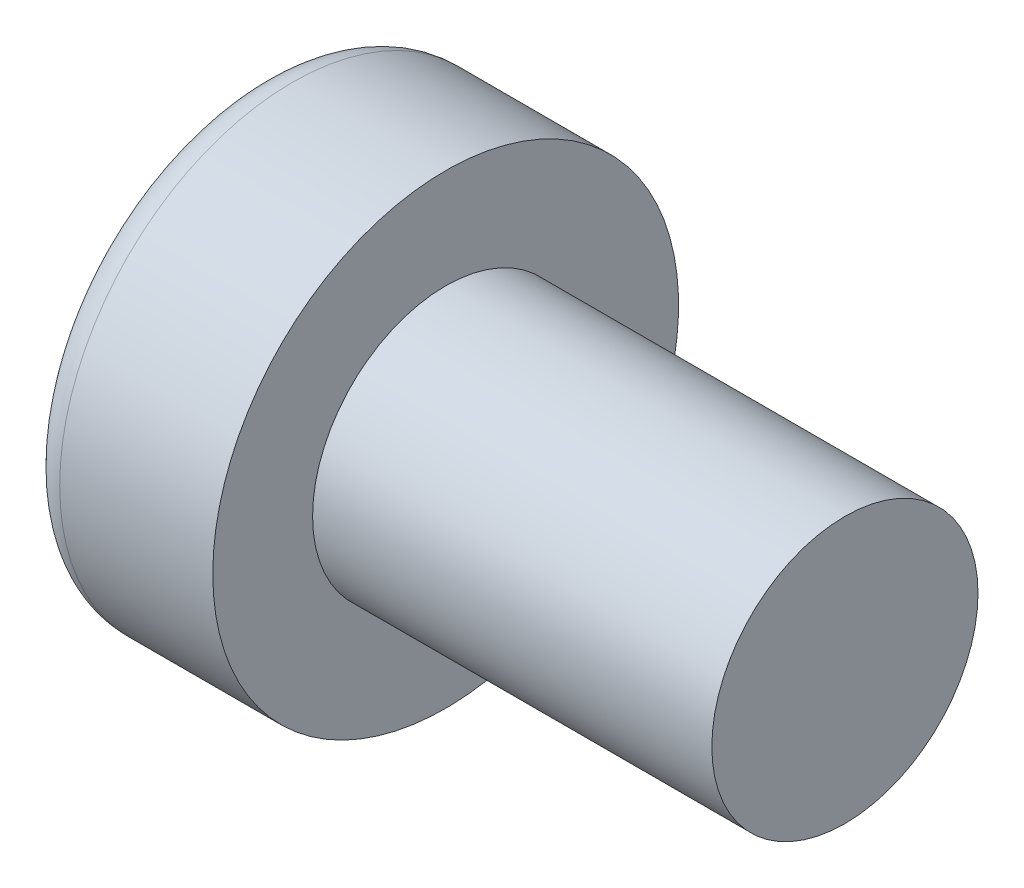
SolidWorks part; units mm, degrees
ref_plane "Ebene vorne" through (0, 0, 0) normal (0, 0, 1) x (1, 0, 0)
ref_plane "Ebene oben" through (0, 0, 0) normal (0, 1, 0) x (1, 0, 0)
ref_plane "Ebene rechts" through (0, 0, 0) normal (1, 0, 0) x (0, 0, -1)
sketch "Skizze1" plane through (0, 0, 0) normal (0, 0, 1) x (1, 0, 0)
  line L0 (-65.0118, 0) -> (64.6036, 0) construction
  line L1 (-8.8, 0) -> (-8.8, 3.5)
  line L2 (-8.8, 3.5) -> (-6, 3.5)
  line L3 (-6, 3.5) -> (-6, 2)
  line L4 (-6, 2) -> (0, 2)
  line L5 (0, 2) -> (0, 0)
  line L6 (0, 0) -> (-8.8, 0)
  dimension "D1" = 4
  dimension "D2" = 6
  dimension "D3" = 7
  dimension "D4" = 2.8
revolve "Rotation1" add sketch "Skizze1" angle 360 about L0
fillet "Verrundung1" radius 0.5 1 edges at (-8.8, 0, 3.5)
sketch "Skizze2" plane through (-8.8, 0, 0) normal (-1, 0, 0) x (0, 0, 1)
  line L1 (1.5, 0.866) -> (0, 1.7321)
  line L2 (0, 1.7321) -> (-1.5, 0.866)
  line L3 (-1.5, 0.866) -> (-1.5, -0.866)
  line L4 (-1.5, -0.866) -> (0, -1.7321)
  line L5 (0, -1.7321) -> (1.5, -0.866)
  line L6 (1.5, -0.866) -> (1.5, 0.866)
  circle A0 centre (0, 0) radius 1.5 construction
  dimension "D1" = 3
extrude "Schnitt-Linear austragen1" cut sketch "Skizze2" against normal blind 3
